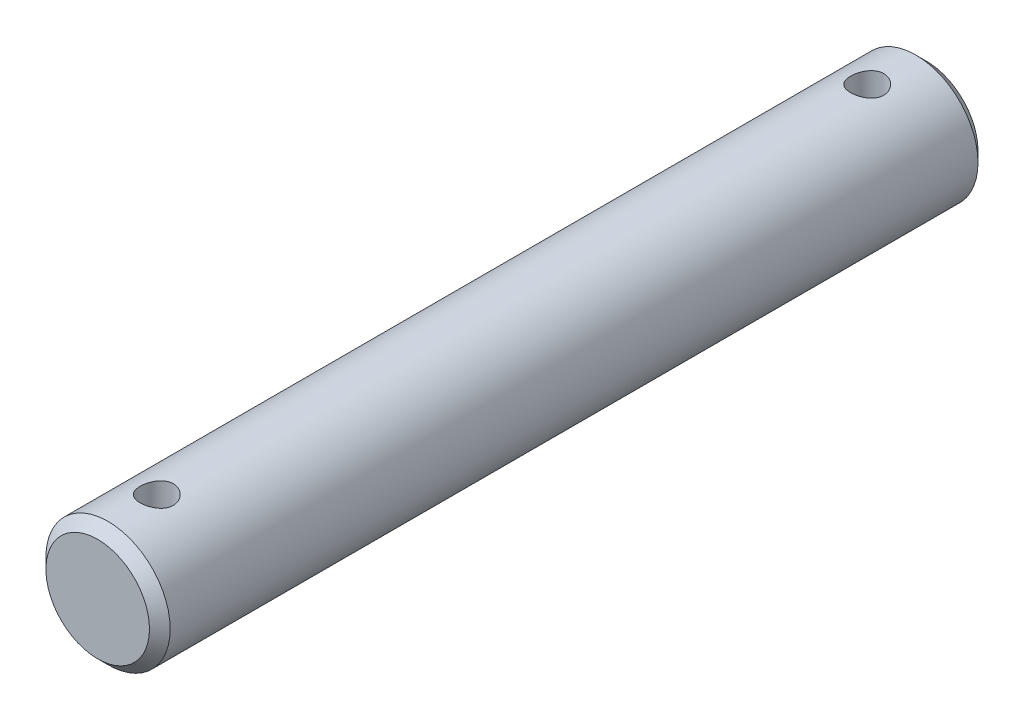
SolidWorks part; units mm, degrees
ref_plane "Frontal" through (0, 0, 0) normal (0, 0, 1) x (1, 0, 0)
ref_plane "Horizontal" through (0, 0, 0) normal (0, 1, 0) x (1, 0, 0)
ref_plane "Vertical" through (0, 0, 0) normal (1, 0, 0) x (0, 0, -1)
sketch "Esquisse1" plane through (0, 0, 0) normal (0, 0, 1) x (1, 0, 0)
  circle A0 centre (0, 0) radius 3
  dimension "D1" = 6
extrude "Extrusion1" add sketch "Esquisse1" along normal mid plane 40
chamfer "Chanfrein1" distance 0.5 angle 45 2 edges at (3, 0, -20) (3, 0, 20)
sketch "Esquisse2" plane through (0, 0, 0) normal (0, 1, 0) x (1, 0, 0)
  line L0 (0, 22.2486) -> (0, -22.7922) construction
  line L1 (-16.7738, 0) -> (15.143, 0) construction
  circle A0 centre (0, 17.15) radius 0.8
  circle A1 centre (0, -17.15) radius 0.8
  dimension "D1" = 1.6
  dimension "D2" = 34.3
extrude "Extrusion2" cut sketch "Esquisse2" against normal through all and the other way through all
